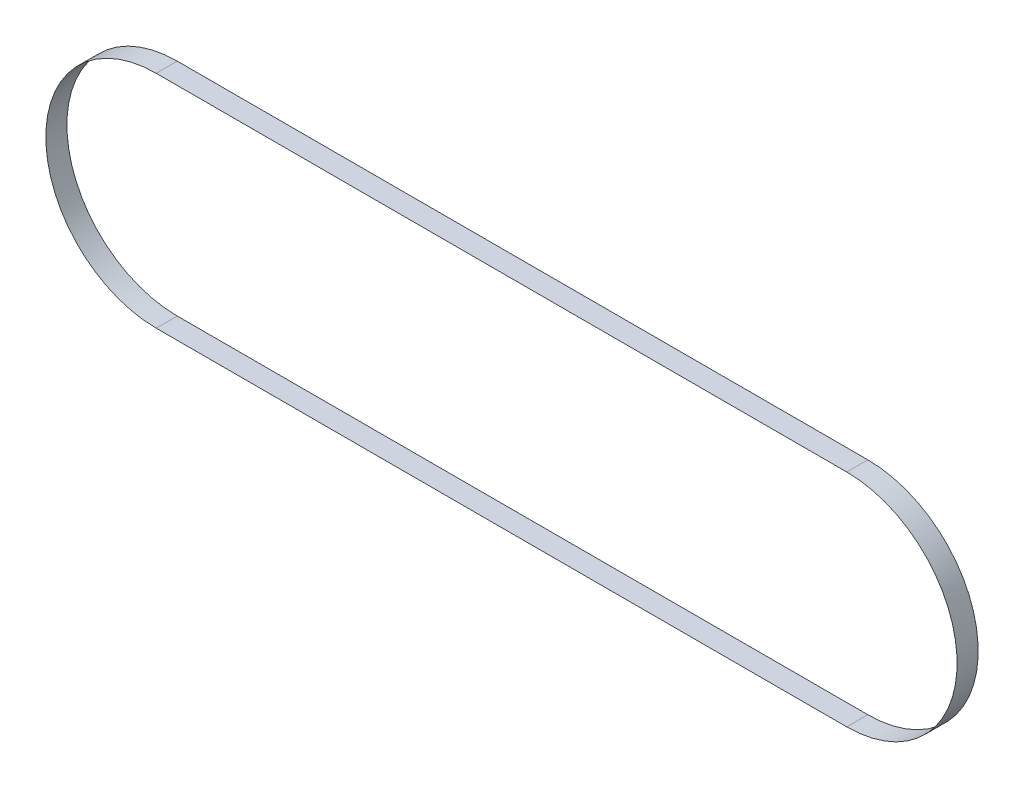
SolidWorks part; units mm, degrees
ref_plane "Ebene vorne" through (0, 0, 0) normal (0, 0, 1) x (1, 0, 0)
ref_plane "Ebene oben" through (0, 0, 0) normal (0, 1, 0) x (1, 0, 0)
ref_plane "Ebene rechts" through (0, 0, 0) normal (1, 0, 0) x (0, 0, -1)
sketch "Skizze2" plane through (0, 0, 0) normal (0, 0, 1) x (1, 0, 0)
  line L0 (0, 0) -> (1, 0) construction
  line L1 (0, 0) -> (0, 1) construction
  line L2 (253.982, -40.595) -> (0, -40.595)
  line L3 (0, 40.595) -> (253.982, 40.595)
  arc A0 (253.982, 40.595) -> (253.982, -40.595) centre (253.982, 0) cw
  arc A1 (0, -40.595) -> (0, 40.595) centre (0, 0) cw
extrude "Linear-Austragen-Dünn1" add sketch "Skizze2" along normal mid plane 7.75 thin
